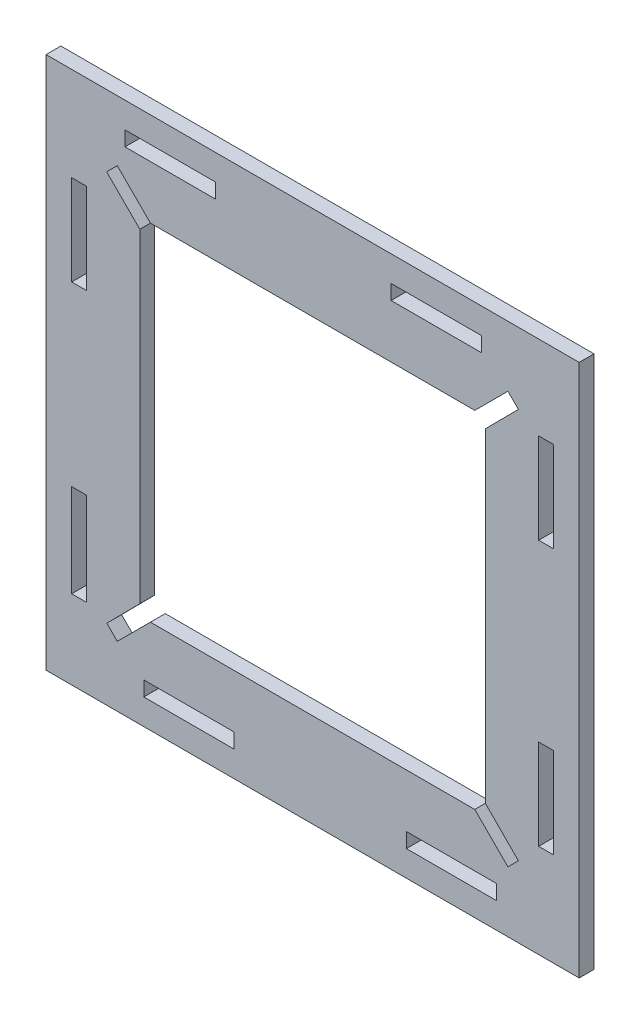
SolidWorks part; units mm, degrees
ref_plane "Alzado" through (0, 0, 0) normal (0, 0, 1) x (1, 0, 0)
ref_plane "Planta" through (0, 0, 0) normal (0, 1, 0) x (1, 0, 0)
ref_plane "Vista lateral" through (0, 0, 0) normal (1, 0, 0) x (0, 0, -1)
sketch "Sketch1" plane through (0, 0, 0) normal (0, 0, 1) x (1, 0, 0)
  line L0 (-38, 48.8) -> (-19.7, 48.8)
  line L1 (-32.85, -35) -> (32.85, -35)
  line L2 (-35, -32.85) -> (-35, 32.85)
  line L3 (-32.85, 35) -> (32.85, 35)
  line L4 (35, -32.85) -> (35, 32.85)
  line L5 (-35, -35) -> (35, 35) construction
  line L6 (-35, 35) -> (35, -35) construction
  line L7 (-54, -54) -> (54, -54)
  line L8 (-54, -54) -> (-54, 54)
  line L9 (-54, 54) -> (54, 54)
  line L10 (54, -54) -> (54, 54)
  line L11 (-54, -54) -> (54, 54) construction
  line L12 (-54, 54) -> (54, -54) construction
  line L13 (15.9, 48.8) -> (34.2, 48.8)
  line L14 (15.9, 48.8) -> (15.9, 45.8)
  line L15 (15.9, 45.8) -> (34.2, 45.8)
  line L16 (34.2, 48.8) -> (34.2, 45.8)
  line L17 (15.9, 48.8) -> (34.2, 45.8) construction
  line L18 (15.9, 45.8) -> (34.2, 48.8) construction
  line L19 (-38, 48.8) -> (-38, 45.8)
  line L20 (-38, 45.8) -> (-19.7, 45.8)
  line L21 (-19.7, 48.8) -> (-19.7, 45.8)
  line L22 (-34.2, -45.8) -> (-15.9, -45.8)
  line L23 (-34.2, -45.8) -> (-34.2, -48.8)
  line L24 (-34.2, -48.8) -> (-15.9, -48.8)
  line L25 (-15.9, -45.8) -> (-15.9, -48.8)
  line L26 (19, -45.8) -> (37.3, -45.8)
  line L27 (19, -45.8) -> (19, -48.8)
  line L28 (19, -48.8) -> (37.3, -48.8)
  line L29 (37.3, -45.8) -> (37.3, -48.8)
  line L30 (32.85, 35) -> (35, 32.85)
  line L31 (-48.8, 35) -> (-45.8, 35)
  line L32 (-48.8, 35) -> (-48.8, 16.7)
  line L33 (-48.8, 16.7) -> (-45.8, 16.7)
  line L34 (-45.8, 35) -> (-45.8, 16.7)
  line L35 (-48.8, 35) -> (-45.8, 16.7) construction
  line L36 (-48.8, 16.7) -> (-45.8, 35) construction
  line L37 (-48.8, -38) -> (-45.8, -38)
  line L38 (-48.8, -38) -> (-48.8, -19.2)
  line L39 (-48.8, -19.2) -> (-45.8, -19.2)
  line L40 (-45.8, -38) -> (-45.8, -19.2)
  line L41 (-48.8, -38) -> (-45.8, -19.2) construction
  line L42 (-48.8, -19.2) -> (-45.8, -38) construction
  line L43 (45.8, -16.7) -> (48.8, -16.7)
  line L44 (45.8, -16.7) -> (45.8, -35)
  line L45 (45.8, -35) -> (48.8, -35)
  line L46 (48.8, -16.7) -> (48.8, -35)
  line L47 (45.8, -16.7) -> (48.8, -35) construction
  line L48 (45.8, -35) -> (48.8, -16.7) construction
  line L49 (45.8, 18.7) -> (48.8, 18.7)
  line L50 (45.8, 18.7) -> (45.8, 37)
  line L51 (45.8, 37) -> (48.8, 37)
  line L52 (48.8, 18.7) -> (48.8, 37)
  line L53 (45.8, 18.7) -> (48.8, 37) construction
  line L54 (45.8, 37) -> (48.8, 18.7) construction
  line L55 (-35, 32.85) -> (-32.85, 35)
  line L56 (-32.85, -35) -> (-35, -32.85)
  line L57 (32.85, -35) -> (35, -32.85)
  line L58 (-35, -32.85) -> (-41.6888, -39.5961)
  line L59 (-32.85, -35) -> (-39.5675, -41.7175)
  line L60 (-39.5675, -41.7175) -> (-41.6888, -39.5961)
  line L61 (-35, 32.85) -> (-41.7175, 39.5675)
  line L62 (-41.7175, 39.5675) -> (-39.5675, 41.7175)
  line L63 (-39.5675, 41.7175) -> (-32.85, 35)
  line L64 (32.85, 35) -> (39.5675, 41.7175)
  line L65 (39.5675, 41.7175) -> (41.6888, 39.5962)
  line L66 (41.6888, 39.5962) -> (35, 32.85)
  line L67 (32.85, -35) -> (39.5675, -41.7175)
  line L68 (39.5675, -41.7175) -> (41.6888, -39.5961)
  line L69 (41.6888, -39.5961) -> (35, -32.85)
  point P0 (0, 0)
  point P6 (0, 0)
  point P11 (25.05, 47.3)
  point P28 (-47.3, 25.85)
  point P33 (-47.3, -28.6)
  point P38 (47.3, -25.85)
  point P43 (47.3, 27.85)
  point P48 (47.3, 37)
  dimension "D1" = 70
  dimension "D2" = 70
  dimension "D3" = 108
  dimension "D4" = 108
  dimension "D5" = 10.8
  dimension "D6" = 3
  dimension "D7" = 19.8
  dimension "D8" = 18.3
  dimension "D9" = 3
  dimension "D10" = 18.3
  dimension "D11" = 16
  dimension "D12" = 10.8
  dimension "D13" = 18.3
  dimension "D14" = 3
  dimension "D15" = 19.8
  dimension "D16" = 10.8
  dimension "D17" = 10.8
  dimension "D18" = 3
  dimension "D19" = 16.7
  dimension "D20" = 18.3
  dimension "D21" = 3
  dimension "D22" = 18.3
  dimension "D23" = 19
  dimension "D24" = 10.8
  dimension "D25" = 16
  dimension "D26" = 18.8
  dimension "D27" = 3
  dimension "D28" = 10.8
  dimension "D29" = 19
  dimension "D30" = 18.3
  dimension "D31" = 3
  dimension "D32" = 10.8
  dimension "D33" = 3
  dimension "D34" = 18.3
  dimension "D35" = 10.8
  dimension "D36" = 17
  dimension "D37" = 9.5
  dimension "D38" = 3
  dimension "D43" = 9.5
  dimension "D44" = 6.7437
  dimension "D45" = 9.5
  dimension "D46" = 3
  dimension "D47" = 9.5
  dimension "D48" = 9.5001
  dimension "D49" = 9.5
  dimension "D50" = 3
  dimension "D51" = 6.1666
extrude "Boss-Extrude1" add sketch "Sketch1" along normal blind 3 contours L7 L10 L9 L8 L69 L68 L67 L1 L59 L60 L58 L2 L61 L62 L63 L3 L64 L65 L66 L4 L52 L49 L50 L51 L40 L37 L38 L39 L13 L16 L15 L14 L0 L21 L20 L19 L22 L25 L24 L23 L26 L29 L28 L27
